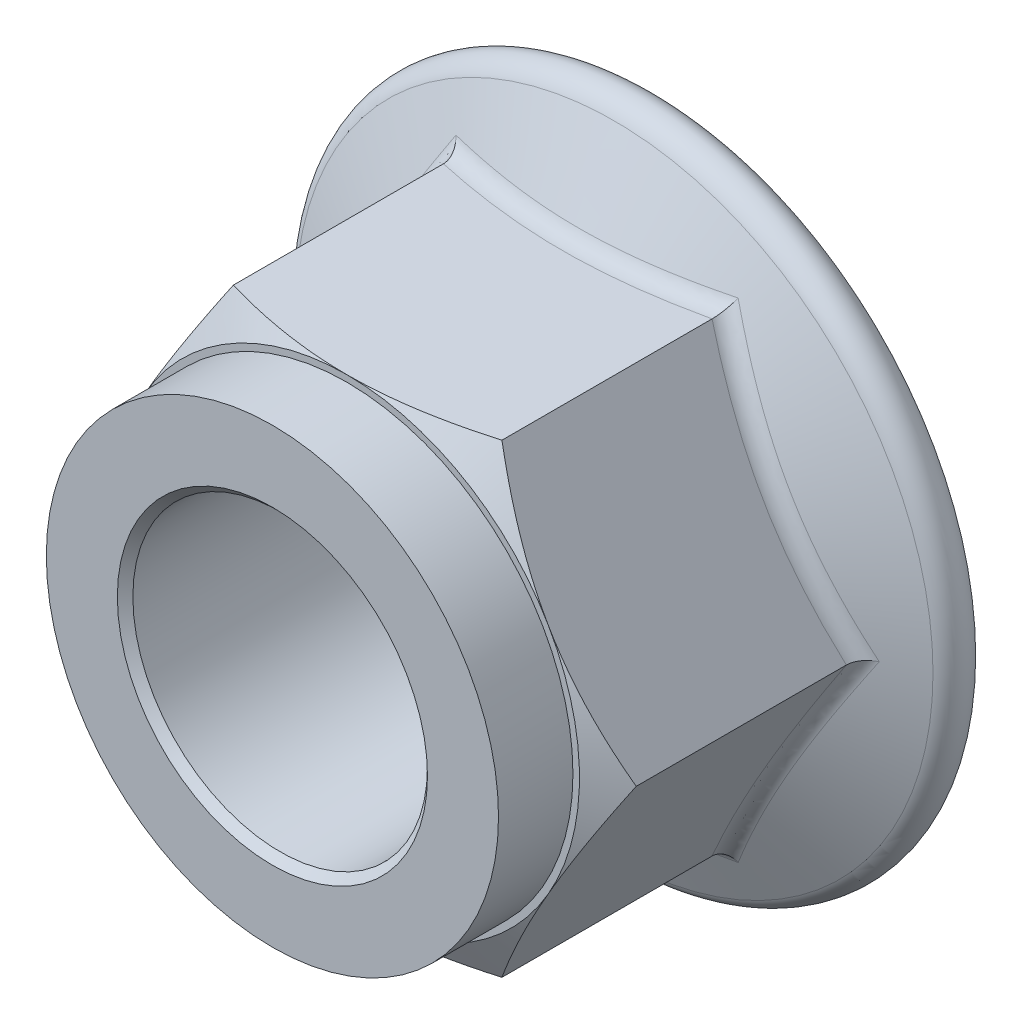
SolidWorks part; units mm, degrees
ref_plane "Front" through (0, 0, 0) normal (0, 0, 1) x (1, 0, 0)
ref_plane "Top" through (0, 0, 0) normal (0, 1, 0) x (1, 0, 0)
ref_plane "Right" through (0, 0, 0) normal (1, 0, 0) x (0, 0, -1)
other "Configuration Table"
sketch "Sketch1" plane through (0, 0, 0) normal (0, 0, 1) x (1, 0, 0)
  line L1 (8.6603, -15) -> (17.3205, 0)
  line L2 (17.3205, 0) -> (8.6603, 15)
  line L3 (8.6603, 15) -> (-8.6603, 15)
  line L4 (-8.6603, 15) -> (-17.3205, 0)
  line L5 (-17.3205, 0) -> (-8.6603, -15)
  line L6 (-8.6603, -15) -> (8.6603, -15)
  circle A0 centre (0, 0) radius 15 construction
  circle A1 centre (0, 0) radius 9.5
extrude "BaseNut" add sketch "Sketch1" against normal blind 20
sketch "Sketch3" plane through (0.6779, 0, -16.6426) normal (0, 1, 0) x (0, 0, -1)
  line L0 (4.0352, 0.6779) -> (-19.0613, 0.6779) construction
  line L2 (-16.6426, 15.6779) -> (-15.3029, 17.9984)
  line L4 (-15.3029, 17.9984) -> (-16.6426, 17.9984)
  line L5 (-16.6426, 17.9984) -> (-16.6426, 15.6779)
  line L6 (-6.6426, 17.9984) -> (-6.6426, 14.238) construction
  line L8 (3.3574, 17.9984) -> (3.3574, 15.6779)
  line L9 (2.0176, 17.9984) -> (3.3574, 17.9984)
  line L10 (3.3574, 15.6779) -> (2.0176, 17.9984)
  line L12 (3.3574, 17.9984) -> (-16.6426, 17.9984) construction
revolve "Double-Chamfer" cut sketch "Sketch3" angle 360 about L0
sketch "Sketch4" plane through (4.6827, 0, -16.7173) normal (0, 1, 0) x (0, 0, -1)
  line L0 (-21.7744, 4.6827) -> (9.7398, 4.6827) construction
  line L2 (3.2827, 14.1827) -> (3.2827, 24.6327)
  line L3 (0.5185, 25.2455) -> (-4.6401, 14.1827)
  line L4 (3.2827, 14.1827) -> (-16.7173, 14.1827) construction
  line L11 (-4.6401, 14.1827) -> (3.2827, 14.1827)
  arc A0 (3.2827, 24.6327) -> (0.5185, 25.2455) centre (1.8327, 24.6327) ccw
revolve "Flange" add sketch "Sketch4" angle 360 about L0
fillet "FlangeFillet" radius 1.2 6 edges at (-15.0051, 4.0104, -14.8899) (10.9757, 10.9896, -14.8899) (-10.9757, -10.9896, -14.8899) (15.0051, -4.0104, -14.8899)
sketch "Sketch5" plane through (-5.1971, 0, -15.1971) normal (0, 1, 0) x (0, 0, -1)
  line L0 (3.5984, -5.1971) -> (-23.9926, -5.1971) construction
  line L2 (-15.1971, 4.8029) -> (-15.1971, 4.3029) construction
  line L4 (-15.1971, 4.3029) -> (-14.6971, 4.3029) construction
  line L6 (-14.6971, 4.3029) -> (-15.1971, 4.8029) construction
  line L7 (-5.1971, -0.987) -> (-5.1971, 4.3029) construction
  line L8 (4.3029, 4.3029) -> (4.8029, 4.8029)
  line L9 (4.8029, 4.3029) -> (4.3029, 4.3029)
  line L10 (4.8029, 4.8029) -> (4.8029, 4.3029)
  line L15 (4.8029, 4.3029) -> (-15.1971, 4.3029) construction
  dimension "da" = 20
  dimension "D2" = 45
revolve "EndChamfer1" cut sketch "Sketch5" angle 360 about L0
sketch "Sketch7" plane through (-3.0723, 10.3605, 0) normal (0, 0, 1) x (1, 0, 0)
  circle A1 centre (3.0723, -10.3605) radius 9.5 construction
  circle A2 centre (3.0723, -10.3605) radius 14.58
  circle A3 centre (3.0723, -10.3605) radius 9.5
  dimension "s1" = 29.16
extrude "TorqueElement" add sketch "Sketch7" along normal offset from surface (4.8 mm away) 24.8
sketch "Sketch8" plane through (-6.8843, 0, -16.8843) normal (0, 1, 0) x (0, 0, -1)
  line L0 (3.9311, -6.8843) -> (-27.6997, -6.8843) construction
  line L2 (-21.6843, 3.1157) -> (-21.1843, 2.6157)
  line L5 (-21.1843, 2.6157) -> (-21.6843, 2.6157)
  line L6 (-21.6843, 2.6157) -> (-21.6843, 3.1157)
  line L7 (-21.6843, 7.6957) -> (-21.6843, -21.4643) construction
  line L9 (2.6157, 2.6157) -> (-21.6843, 2.6157) construction
  dimension "D1" = 45
revolve "EndChamfer2" cut sketch "Sketch8" angle 360 about L0
sketch "Sketch9" plane through (0, 0, 0) normal (0, 1, 0) x (1, 0, 0)
  line L0 (0, 27.1353) -> (0, -11.1539) construction
  line L1 (9, 19.75) -> (9.5, 19.75)
  line L2 (9.5, 19.75) -> (9.933, 19.5)
  line L3 (9.933, 19.5) -> (9.5, 19.25)
  line L4 (9.5, 19.25) -> (9, 19.25)
  line L5 (9, 19.25) -> (9, 19.75)
  line L6 (-9.5, 19.5) -> (9.5, 19.5) construction
revolve "Cut-Revolve10" [suppressed] cut sketch "Sketch9" angle 360 about L0
pattern_linear "LPattern10" [suppressed] count 40 spacing 0.6 along (0, 0, -1)
equation "\"m1@Sketch4\" = \"m@BaseNut\""
equation "\"sq@Sketch3\" = \"s@Sketch1\""
equation "\"D2@Sketch9\" = \"xd@Sketch1\""
equation "\"D1@Sketch9\" = (  \"D2@ThreadCosmetic1\" - \"xd@Sketch1\" )  / 2"
equation "\"D3@LPattern10\" = \"D1@Sketch9\" * 1.2"
equation "\"D1@LPattern10\" =\"h@TorqueElement\" / \"D3@LPattern10\"-1"
